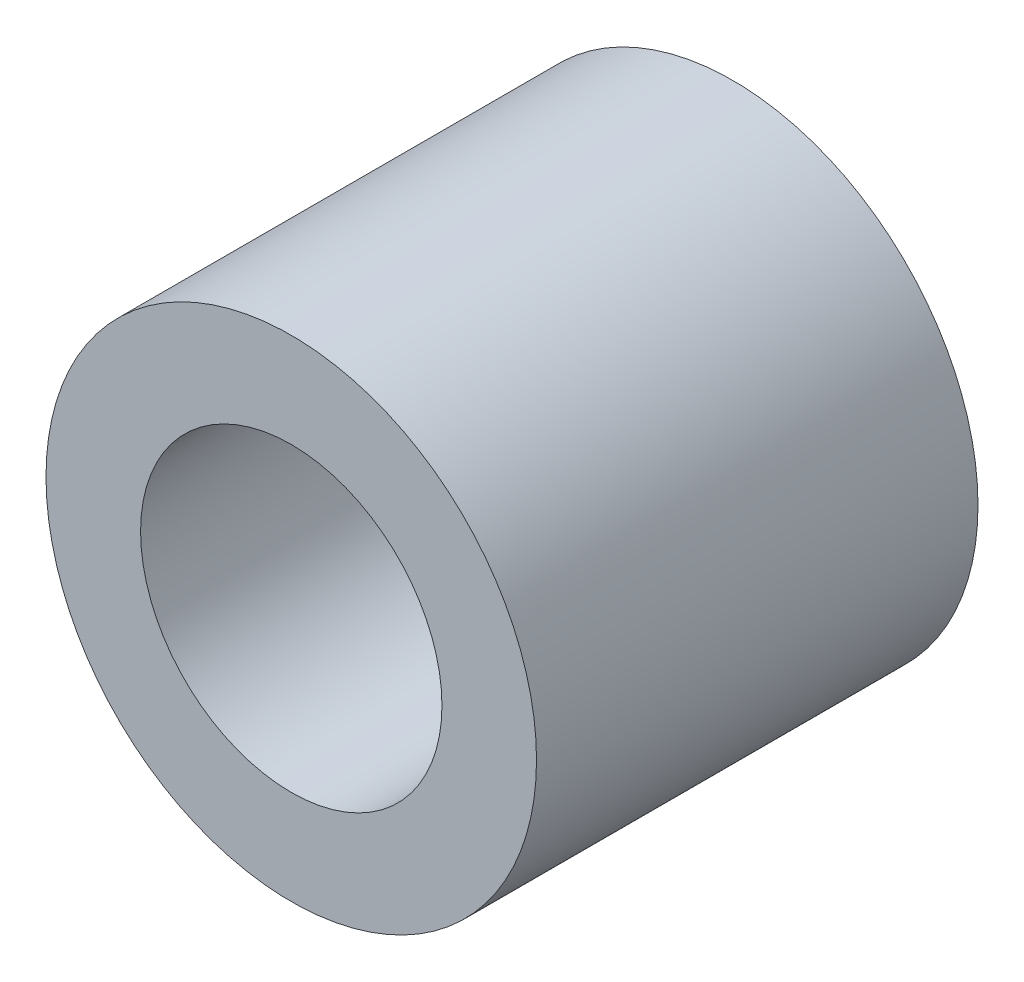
SolidWorks part; units mm, degrees
ref_plane "Front Plane" through (0, 0, 0) normal (0, 0, 1) x (1, 0, 0)
ref_plane "Top Plane" through (0, 0, 0) normal (0, 1, 0) x (1, 0, 0)
ref_plane "Right Plane" through (0, 0, 0) normal (1, 0, 0) x (0, 0, -1)
sketch "Sketch1" plane through (0, 0, 0) normal (0, 0, 1) x (1, 0, 0)
  circle A0 centre (0, 0) radius 3.9688
  circle A1 centre (0, 0) radius 2.4384
  dimension "OD" = 7.9375
  dimension "ID" = 4.8768
extrude "Extrude1" add sketch "Sketch1" along normal mid plane 7.1437
sketch "Sketch2" plane through (0, 0, 0) normal (1, 0, 0) x (0, 0, -1)
  line L0 (-3.5719, -2.4384) -> (3.5719, -2.4384) construction
  line L3 (3.5719, 2.4384) -> (-3.5719, 2.4384) construction
  line L5 (-3.5719, -2.4384) -> (3.5719, -2.4384)
  line L6 (3.5719, 2.4384) -> (-3.5719, 2.4384)
sketch "Sketch4" plane through (0, 0, 3.5719) normal (0, 0, 1) x (1, 0, 0)
  line L0 (0, 0) -> (-1.7242, 1.7242)
  line L1 (0, -2.1828) -> (0, 2.1828) construction
  circle A0 centre (0, 0) radius 2.4384 construction
  dimension "D1" = 45
